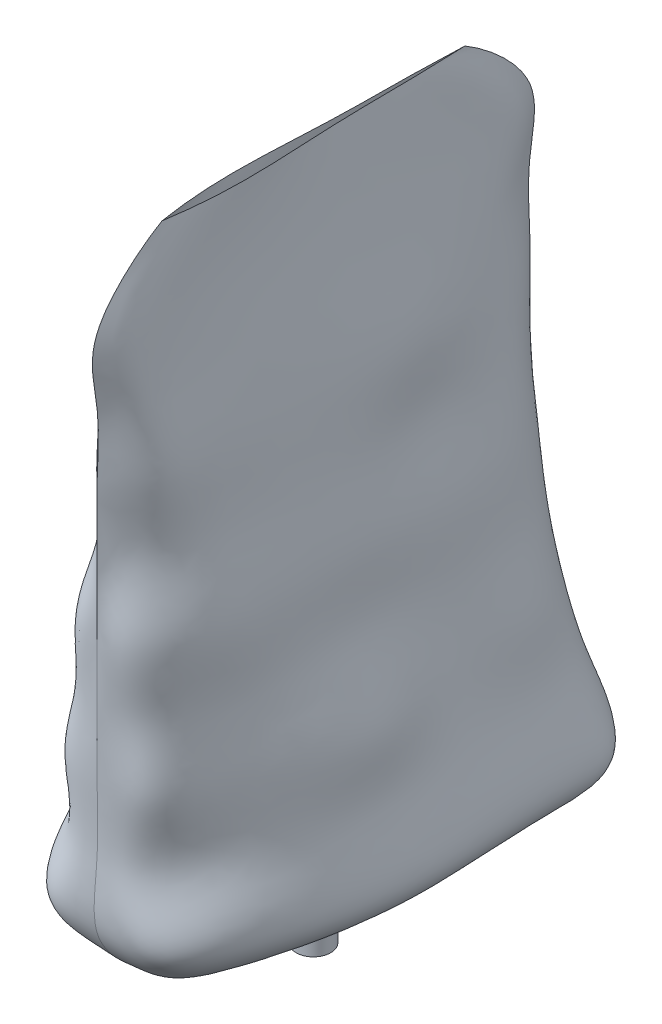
SolidWorks part; units mm, degrees
ref_plane "Front Plane" through (0, 0, 0) normal (0, 0, 1) x (1, 0, 0)
ref_plane "Top Plane" through (0, 0, 0) normal (0, 1, 0) x (1, 0, 0)
ref_plane "Right Plane" through (0, 0, 0) normal (1, 0, 0) x (0, 0, -1)
sketch "Sketch1" plane through (0, 0, 0) normal (1, 0, 0) x (0, 0, -1)
  line L1 (-44.45, 95.25) -> (44.45, 95.25)
  line L2 (-63.5, 76.2) -> (-63.5, -76.2)
  line L3 (-44.45, -95.25) -> (44.45, -95.25)
  line L4 (63.5, 76.2) -> (63.5, -76.2)
  arc A0 (-44.45, 95.25) -> (-63.5, 76.2) centre (-44.45, 76.2) ccw
  arc A1 (44.45, 95.25) -> (63.5, 76.2) centre (44.45, 76.2) cw
  arc A2 (-63.5, -76.2) -> (-44.45, -95.25) centre (-44.45, -76.2) ccw
  arc A3 (44.45, -95.25) -> (63.5, -76.2) centre (44.45, -76.2) ccw
  point P6 (-63.5, 95.25)
  point P9 (63.5, 95.25)
  point P12 (-63.5, -95.25)
  point P15 (0, 95.25)
  point P17 (-63.5, 0)
  dimension "D3" = 19.05
  dimension "D1" = 127
  dimension "D2" = 190.5
ref_plane "Plane1" through (0, 19.05, 0) normal (0, 1, 0) x (-1, 0, 0)
ref_plane "Plane2" through (0, 38.1, 0) normal (0, 1, 0) x (-1, 0, 0)
ref_plane "Plane3" through (0, 57.15, 0) normal (0, 1, 0) x (-1, 0, 0)
ref_plane "Plane4" through (0, 76.2, 0) normal (0, 1, 0) x (-1, 0, 0)
ref_plane "Plane5" through (0, 95.25, 0) normal (0, 1, 0) x (-1, 0, 0)
ref_plane "Plane6" through (0, -19.05, 0) normal (0, 1, 0) x (-1, 0, 0)
ref_plane "Plane7" through (0, -38.1, 0) normal (0, 1, 0) x (-1, 0, 0)
ref_plane "Plane8" through (0, -57.15, 0) normal (0, 1, 0) x (-1, 0, 0)
ref_plane "Plane9" through (0, -76.2, 0) normal (0, 1, 0) x (-1, 0, 0)
ref_plane "Plane10" through (0, -95.25, 0) normal (0, 1, 0) x (-1, 0, 0)
sketch "Sketch3" plane through (0, 76.2, 0) normal (0, 1, 0) x (-1, 0, 0)
  spline S0 degree 3 poles (0, 63.5) (0.9575, 61.5622) (4.2275, 54.9445) (2.2346, 32.9141) (5.6307, -0.4347) (3.2579, -33.1095) (5.3658, -55.7368) (1.2628, -61.6731) (0, -63.5) knots 0 0 0 0 0.049907 0.17044 0.498457 0.83467 0.949118 1 1 1 1
sketch "Sketch4" plane through (0, 57.15, 0) normal (0, 1, 0) x (-1, 0, 0)
  spline S0 degree 3 poles (0, 63.5) (1.9697, 61.3063) (5.9864, 56.8327) (5.8447, 34.1727) (10.3337, 4.642) (7.9012, -27.7323) (8.2126, -49.9805) (2.7341, -58.9991) (0, -63.5) knots 0 0 0 0 0.065433 0.133437 0.500323 0.762255 0.88135 1 1 1 1
sketch "Sketch5" plane through (0, 38.1, 0) normal (0, 1, 0) x (-1, 0, 0)
  spline S0 degree 3 poles (0, 63.5) (3.4981, 60.2113) (9.81, 54.2771) (10.3706, 33.3696) (13.1754, 11.0532) (13.4591, -15.097) (10.7804, -35.036) (9.9451, -52.816) (2.759, -60.5361) (0, -63.5) knots 0 0 0 0 0.10312 0.18607 0.451073 0.621231 0.768037 0.910942 1 1 1 1
sketch "Sketch6" plane through (0, 19.05, 0) normal (0, 1, 0) x (-1, 0, 0)
  spline S0 degree 3 poles (0, 63.5) (2.5112, 61.1281) (10.3129, 53.7591) (14.1139, 30.4765) (17.1762, 3.1139) (10.028, -24.16) (15.4639, -48.4752) (4.8029, -58.8335) (0, -63.5) knots 0 0 0 0 0.075593 0.234853 0.498349 0.688698 0.859754 1 1 1 1
  spline S1 degree 3 poles (1769.7171, 991.7437) (-253.7921, 43.2309) (8.5267, 102.1349) (10.3706, 33.3696) (13.1754, 11.0532) (13.4591, -15.097) (10.7804, -35.036) (7.5249, -104.3339) (-214.6549, -62.6561) (1739.2868, -1047.1977) knots -1.032522 -1.032522 -1.032522 -1.032522 0.10312 0.18607 0.451073 0.621231 0.768037 0.910942 2.097491 2.097491 2.097491 2.097491 only from (0, 63.5) to (0, -63.5) construction
sketch "Sketch7" plane through (0, 0, 0) normal (0, 1, 0) x (1, 0, 0)
  spline S0 degree 3 poles (0, 63.5) (-4.577, 60.3693) (-11.9312, 55.339) (-17.8477, 39.7929) (-15.9502, 21.6756) (-19.7771, -2.2792) (-18.7752, -27.448) (-17.0556, -49.0721) (-8.1308, -63.2811) (-1.6981, -63.4543) (0, -63.5) knots 0 0 0 0 0.114188 0.183477 0.340063 0.493267 0.69679 0.867533 0.965031 1 1 1 1
sketch "Sketch8" plane through (0, -19.05, 0) normal (0, 1, 0) x (-1, 0, 0)
  spline S0 degree 3 poles (0, 63.5) (2.7179, 63.1284) (11.3899, 61.9427) (18.4567, 40.2127) (22.5416, 14.2124) (17.6264, -15.3483) (20.3062, -38.0528) (15.0721, -56.5359) (5.0149, -61.1829) (0, -63.5) knots 0 0 0 0 0.054469 0.173794 0.407842 0.632639 0.779142 0.889873 1 1 1 1
  spline S1 degree 3 poles (1450.4728, -1437.1598) (-246.0231, 6.0351) (-7.8323, -107.2691) (17.8477, -39.7929) (15.9502, -21.6756) (19.7771, 2.2792) (18.7752, 27.448) (17.0556, 49.0721) (-8.7953, 90.2288) (-101.8944, -48.7603) (701.3368, 1935.7599) knots -1.135945 -1.135945 -1.135945 -1.135945 0.114188 0.183477 0.340063 0.493267 0.69679 0.867533 0.965031 1.575043 1.575043 1.575043 1.575043 only from (0, -63.5) to (0, 63.5) construction
sketch "Sketch9" plane through (0, -38.1, 0) normal (0, 1, 0) x (-1, 0, 0)
  spline S0 degree 3 poles (0, 63.5) (4.0062, 63.3946) (14.1892, 63.1268) (21.7118, 37.0954) (32.8243, 12.0767) (20.631, -17.0075) (25.9446, -38.6637) (17.7147, -59.9033) (5.4509, -62.3933) (0, -63.5) knots 0 0 0 0 0.072759 0.184938 0.460962 0.611521 0.765758 0.895886 1 1 1 1
sketch "Sketch10" plane through (0, -57.15, 0) normal (0, 1, 0) x (-1, 0, 0)
  spline S0 degree 3 poles (0, 63.5) (2.4333, 63.5661) (9.0217, 63.7452) (19.985, 51.3146) (29.8849, 28.2469) (28.6945, -6.2343) (28.1255, -34.6427) (23.8864, -64.2624) (8.2627, -63.7637) (0, -63.5) knots 0 0 0 0 0.044465 0.120392 0.285432 0.521143 0.7451 0.865195 1 1 1 1
  spline S1 degree 3 poles (1065.5324, 1754.7401) (-194.1301, -99.3976) (2.0381, 105.1748) (21.7118, 37.0954) (32.8243, 12.0767) (20.631, -17.0075) (25.9446, -38.6637) (-2.959, -113.2575) (-223.4561, 95.9202) (1034.5152, -1772.9711) knots -0.744583 -0.744583 -0.744583 -0.744583 0.072759 0.184938 0.460962 0.611521 0.765758 0.895886 1.975867 1.975867 1.975867 1.975867 only from (0, 63.5) to (0, -63.5) construction
sketch "Sketch11" plane through (0, -76.2, 0) normal (0, 1, 0) x (-1, 0, 0)
  spline S0 degree 3 poles (0, 63.5) (4.8385, 63.8442) (18.5767, 64.8216) (32.7616, 34.0601) (36.2996, -2.5698) (33.4358, -34.5997) (33.2346, -56.2388) (19.9198, -65.2346) (8.1373, -64.2086) (0, -63.5) knots 0 0 0 0 0.079729 0.22638 0.497631 0.751974 0.796078 0.859168 1 1 1 1
sketch "Sketch12" plane through (0, -95.25, 0) normal (0, 1, 0) x (-1, 0, 0)
  line L0 (0, 63.5) -> (0, 44.45) construction
  line L1 (0, 44.45) -> (0, -44.45) construction
  line L2 (0, -44.45) -> (0, -63.5) construction
  spline S0 degree 3 poles (0, 44.45) (1.3737, 42.1984) (3.8801, 38.0901) (2.5381, 25.7428) (4.6028, 6.9792) (5.376, -18.592) (1.7152, -36.2) (0, -44.45) knots 0 0 0 0 0.085135 0.155334 0.401896 0.719766 1 1 1 1
  spline S3 degree 3 poles (1918.4826, 624.3406) (-143.0367, 105.88) (7.8157, 94.6096) (2.2346, 32.9141) (5.6307, -0.4347) (3.2579, -33.1095) (8.8307, -92.9303) (-158.9541, -83.0136) (1871.5264, -765.7385) knots -0.89746 -0.89746 -0.89746 -0.89746 0.049907 0.17044 0.498457 0.83467 0.949118 1.824409 1.824409 1.824409 1.824409 only from (0, 63.5) to (0, -63.5) construction
sketch "Sketch13" plane through (0, 95.25, 0) normal (0, 1, 0) x (-1, 0, 0)
  spline S0 degree 3 poles (0, 44.45) (0.1477, 43.4821) (1.0672, 37.4549) (2.5282, 19.9697) (0.4567, -4.0201) (0.6111, -27.5959) (0.1699, -39.7646) (0, -44.45) knots 0 0 0 0 0.033002 0.2055 0.589638 0.841994 1 1 1 1
surface "Surface-Loft5"
mirror "Mirror1" about plane through (0, 0, 0) normal (1, 0, 0)
surface "Surface-Knit1"
surface "Surface-Fill1"
sketch "Sketch14" plane through (0, -95.25, 0) normal (0, 1, 0) x (-1, 0, 0)
  circle A0 centre (0, 0) radius 5.08
  dimension "D1" = 10.16
extrude "Extrude1" add sketch "Sketch14" against normal blind 15.24
sketch "Sketch15" plane through (0, 0, 0) normal (1, 0, 0) x (0, 0, -1)
  line L0 (-44.45, 95.25) -> (44.45, 95.25)
